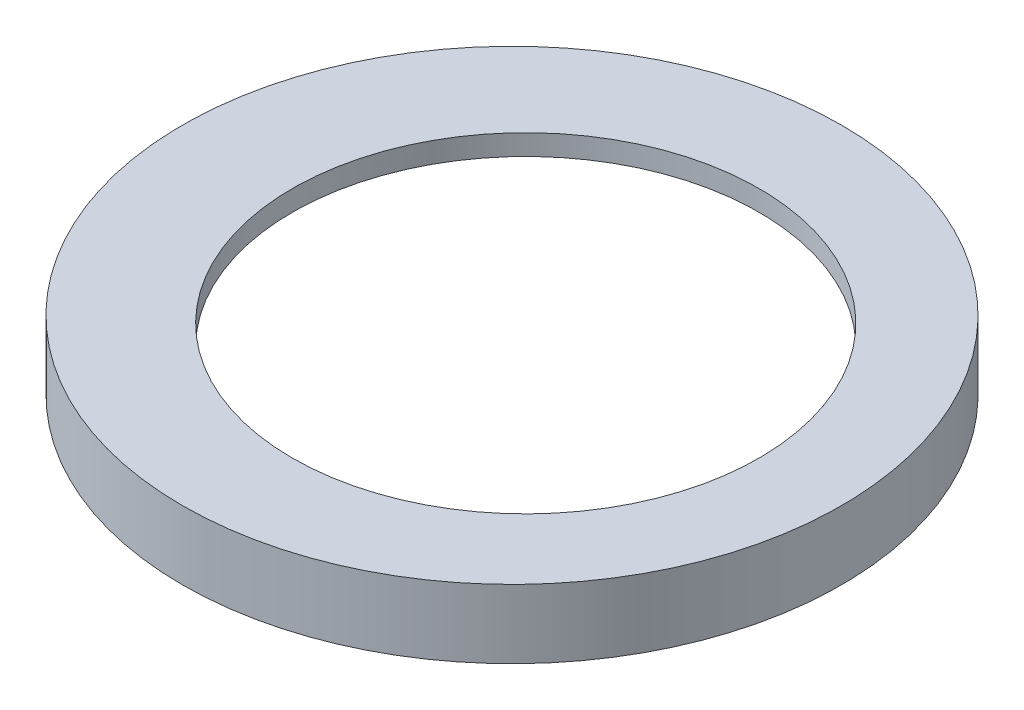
SolidWorks part; units mm, degrees
ref_plane "前视基准面" through (0, 0, 0) normal (0, 0, 1) x (1, 0, 0)
ref_plane "上视基准面" through (0, 0, 0) normal (0, 1, 0) x (1, 0, 0)
ref_plane "右视基准面" through (0, 0, 0) normal (1, 0, 0) x (0, 0, -1)
sketch "草图1" plane through (0, 0, 0) normal (0, 1, 0) x (1, 0, 0)
  circle A0 centre (0, 0) radius 17
  circle A1 centre (-1, 0) radius 23.2
  dimension "D1" = 1
  dimension "D2" = 46.4
  dimension "D3" = 34
extrude "凸台-拉伸1" add sketch "草图1" along normal blind 1.5
sketch "草图2" plane through (0, 1.5, 0) normal (0, 1, 0) x (1, 0, 0)
  circle A0 centre (-1, 0) radius 23.2
  circle A1 centre (-1, 0) radius 24
extrude "凸台-拉伸2" add sketch "草图2" against normal blind 5
sketch "草图3" plane through (0, 0, 0) normal (0, -1, 0) x (-1, 0, 0)
  circle A0 centre (22, 0) radius 1.35
  dimension "D1" = 22
  dimension "D2" = 2.7
extrude "凸台-拉伸3" add sketch "草图3" along normal blind 0.45
